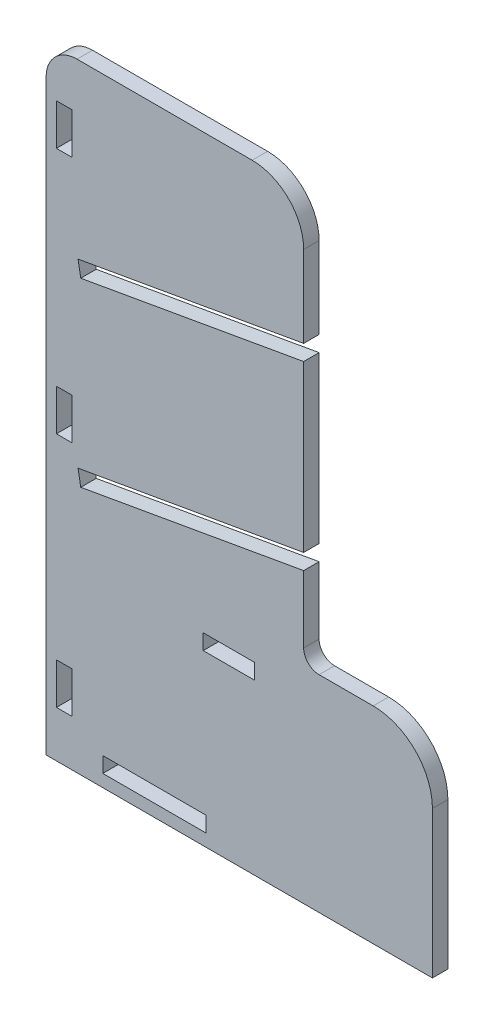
SolidWorks part; units mm, degrees
ref_plane "Front Plane" through (0, 0, 0) normal (0, 0, 1) x (1, 0, 0)
ref_plane "Top Plane" through (0, 0, 0) normal (0, 1, 0) x (1, 0, 0)
ref_plane "Right Plane" through (0, 0, 0) normal (1, 0, 0) x (0, 0, -1)
sketch "Croquis1" plane through (0, 0, 0) normal (0, 0, 1) x (1, 0, 0)
  line L0 (-125, 270) -> (-125, -300)
  line L1 (-125, -300) -> (250, -300)
  line L2 (250, -300) -> (250, -157.5)
  line L3 (192.5, -100) -> (140, -100)
  line L4 (125, -85) -> (125, 250)
  line L5 (75, 300) -> (-95, 300)
  arc A0 (-125, 270) -> (-95, 300) centre (-95, 270) cw
  arc A1 (125, 250) -> (75, 300) centre (75, 250) ccw
  arc A2 (250, -157.5) -> (192.5, -100) centre (192.5, -157.5) ccw
  arc A3 (125, -85) -> (140, -100) centre (140, -85) ccw
  point P9 (-125, 300)
  point P14 (250, -100)
  point P18 (125, -100)
  dimension "D8" = 30
  dimension "D9" = 50
  dimension "D10" = 57.5
  dimension "D11" = 15
  dimension "D1" = 600
  dimension "D2" = 125
  dimension "D3" = 125
  dimension "D4" = 375
  dimension "D5" = 125
  dimension "D6" = 300
  dimension "D7" = 200
extrude "Saliente-Extruir1" add sketch "Croquis1" along normal blind 15
sketch "Croquis3" plane through (0, 0, 15) normal (0, 0, 1) x (1, 0, 0)
  line L0 (-125, 270) -> (-125, -300) construction
  line L1 (-115, 255) -> (-100, 255)
  line L2 (-115, 255) -> (-115, 215)
  line L3 (-115, 215) -> (-100, 215)
  line L4 (-100, 255) -> (-100, 215)
  line L5 (-100, 255) -> (-100, 614.6619) construction
  line L6 (75, 300) -> (-95, 300) construction
  line L7 (-115, -215) -> (-100, -215)
  line L8 (-115, -215) -> (-115, -255)
  line L9 (-115, -255) -> (-100, -255)
  line L10 (-100, -215) -> (-100, -255)
  line L11 (-125, -300) -> (250, -300) construction
  line L13 (-115, -25) -> (-100, -25)
  line L14 (-115, -25) -> (-115, 15)
  line L15 (-115, 15) -> (-100, 15)
  line L16 (-100, -25) -> (-100, 15)
  dimension "D1" = 15
  dimension "D2" = 40
  dimension "D3" = 25
  dimension "D4" = 45
  dimension "D5" = 10
  dimension "D6" = 45
  dimension "D7" = 40
  dimension "D8" = 15
  dimension "D9" = 40
  dimension "D10" = 10
  dimension "D11" = 15
  dimension "D12" = 275
extrude "Cortar-Extruir2" cut sketch "Croquis3" against normal up to next
sketch "Croquis4" plane through (0, 0, 15) normal (0, 0, 1) x (1, 0, 0)
  line L0 (-125, -300) -> (250, -300) construction
  line L1 (27.5, -121) -> (77.5, -121)
  line L2 (27.5, -121) -> (27.5, -136)
  line L3 (27.5, -136) -> (77.5, -136)
  line L4 (77.5, -121) -> (77.5, -136)
  line L5 (-125, 270) -> (-125, -300) construction
  dimension "D1" = 50
  dimension "D2" = 15
  dimension "D3" = 164
  dimension "D4" = 152.5
extrude "Cortar-Extruir3" cut sketch "Croquis4" against normal up to next
sketch "Croquis6" plane through (0, 0, 15) normal (0, 0, 1) x (1, 0, 0)
  line L0 (-125, -300) -> (250, -300) construction
  line L1 (-70, -273) -> (30, -273)
  line L2 (-70, -273) -> (-70, -288)
  line L3 (-70, -288) -> (30, -288)
  line L4 (30, -273) -> (30, -288)
  line L5 (-125, 270) -> (-125, -300) construction
  dimension "D1" = 100
  dimension "D2" = 15
  dimension "D3" = 12
  dimension "D4" = 55
extrude "Cortar-Extruir4" cut sketch "Croquis6" against normal up to next
sketch "Croquis7" plane through (0, 0, 15) normal (0, 0, 1) x (1, 0, 0)
  line L0 (125, 171) -> (-94, 132.3844)
  line L1 (125, -85) -> (125, 250) construction
  line L2 (-94, 132.3844) -> (-91.3953, 117.6123)
  line L3 (-91.3953, 117.6123) -> (125, 155.7686)
  line L4 (125, 155.7686) -> (125, 171)
  line L5 (192.5, -100) -> (140, -100) construction
  line L6 (75, 300) -> (-95, 300) construction
  line L11 (125, -4.7686) -> (-94, -43.3842)
  line L12 (-94, -43.3842) -> (-91.3953, -58.1563)
  line L13 (-91.3953, -58.1563) -> (125, -20)
  line L14 (125, -20) -> (125, -4.7686)
  line L16 (-125, 270) -> (-125, -300) construction
  line L17 (-100, 235) -> (-100, -192.5819) construction
  line L18 (-100, 215) -> (-100, 255) construction
  dimension "D1" = 15
  dimension "D2" = 31
  dimension "D3" = 400
  dimension "D4" = 31
  dimension "D5" = 15
  dimension "D6" = 100
  dimension "D7" = 80
  dimension "D8" = 160.5372
  dimension "D9" = 129
  dimension "D10" = 100
extrude "Cortar-Extruir5" cut sketch "Croquis7" along normal through all and the other way blind 781
